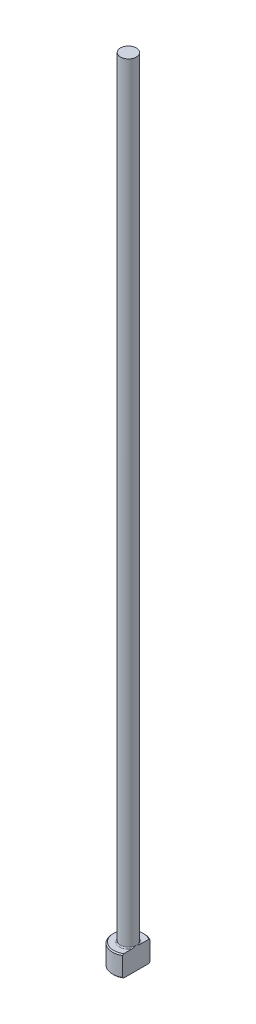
SolidWorks part; units mm, degrees
ref_plane "Front Plane" through (0, 0, 0) normal (0, 0, 1) x (1, 0, 0)
ref_plane "Top Plane" through (0, 0, 0) normal (0, 1, 0) x (1, 0, 0)
ref_plane "Right Plane" through (0, 0, 0) normal (1, 0, 0) x (0, 0, -1)
sketch "Sketch1" plane through (0, 0, 0) normal (0, 0, 1) x (1, 0, 0)
  line L0 (0, 259.9588) -> (0, -15.1925) construction
  line L1 (0, 0) -> (-3, 0)
  line L2 (-3, 0) -> (-3, 4)
  line L3 (-3, 4) -> (-1.5, 4)
  line L4 (-1.5, 4) -> (-1.5, 150)
  line L5 (-1.5, 150) -> (0, 150)
  line L6 (0, 150) -> (0, 0)
  dimension "L" = 150
  dimension "H" = 6
  dimension "T" = 4
  dimension "D" = 3
revolve "Revolve1" add sketch "Sketch1" angle 360 about L0
chamfer "Chamfer1" distance 0.2 angle 45 2 edges at (0, 4, 3) (0, 0, 3)
fillet "Fillet1" radius 0.2 1 edges at (0, 4, 1.5)
sketch "Sketch2" plane through (0, 0, 0) normal (0, 1, 0) x (1, 0, 0)
  line L0 (1.5, -2.5981) -> (1.5, 2.5981)
  circle A0 centre (0, 0) radius 3 construction
  arc A1 (1.5, -2.5981) -> (1.5, 2.5981) centre (0, 0) ccw
  circle A2 centre (0, 0) radius 1.5 construction
extrude "KEYED HEAD" cut sketch "Sketch2" along normal through all
